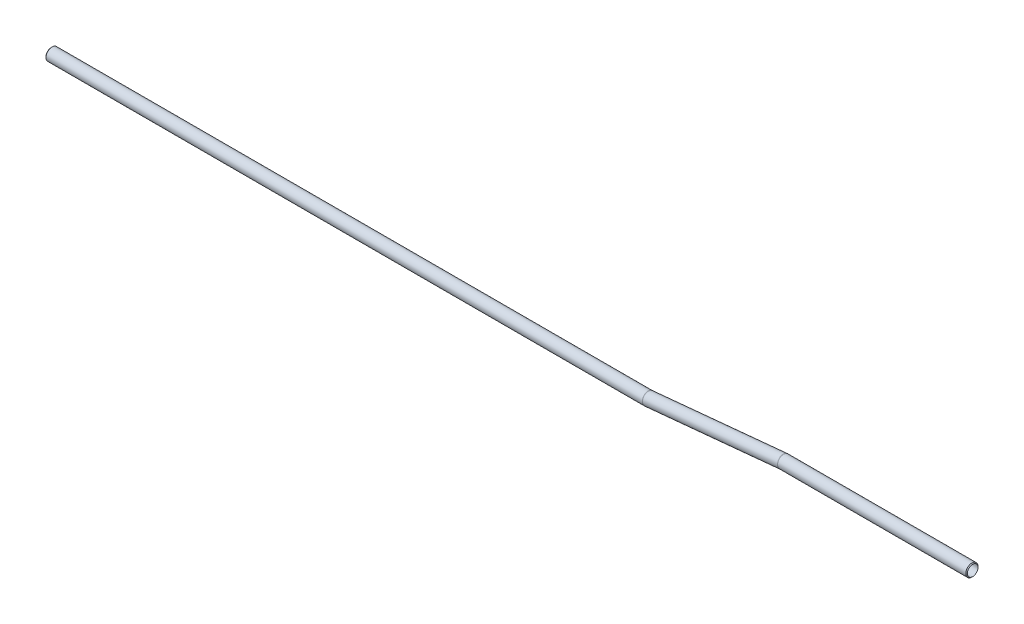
SolidWorks part; units mm, degrees
ref_plane "Front Plane" through (0, 0, 0) normal (0, 0, 1) x (1, 0, 0)
ref_plane "Top Plane" through (0, 0, 0) normal (0, 1, 0) x (1, 0, 0)
ref_plane "Right Plane" through (0, 0, 0) normal (1, 0, 0) x (0, 0, -1)
sketch "Sketch1" plane through (0, 0, 0) normal (0, 0, 1) x (1, 0, 0)
  line L0 (-287.0962, -5.482) -> (-369.5962, -5.482)
  line L1 (0, 0) -> (20, 0)
  line L2 (-287.0962, -5.482) -> (-117.0962, -5.482)
  line L3 (0, 0) -> (-60, 0)
  line L4 (-117.0962, -5.482) -> (-60, 0)
  dimension "D1" = 170
  dimension "D2" = 60
  dimension "D3" = 82.5
  dimension "D4" = 20
ref_plane "Plane1" through (20, 0, 0) normal (1, 0, 0) x (0, 0, -1)
sketch "Sketch2" plane through (20, 0, 0) normal (1, 0, 0) x (0, 0, -1)
  circle A0 centre (0, 0) radius 2.5848
  circle A1 centre (0, 0) radius 2.25
  dimension "D1" = 5.1695
  dimension "D2" = 4.5
sweep "Sweep2" add profiles "Sketch2" path "Sketch1"
chamfer "Chamfer1" distance 0.5 angle 45 2 edges at (-369.5962, -8.0668, 0) (20, 0, -2.5848)
fillet "Fillet1" radius 2 2 edges at (-60.1238, 2.5847, 0) (-116.9724, -8.0668, 0)
